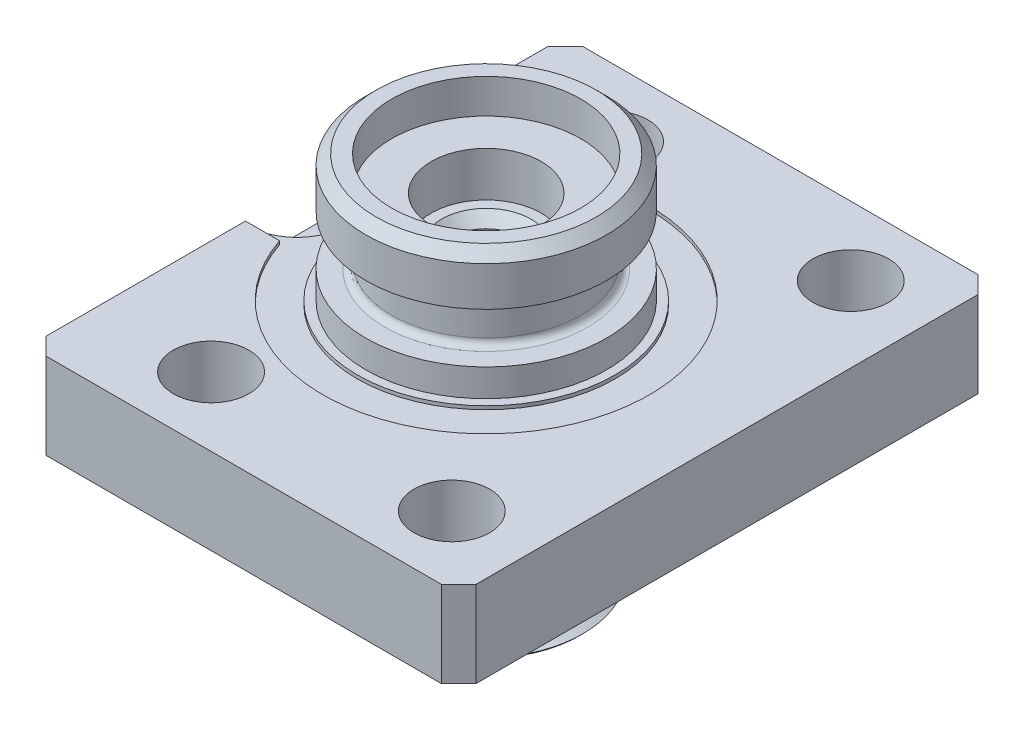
SolidWorks part; units mm, degrees
ref_plane "前视基准面" through (0, 0, 0) normal (0, 0, 1) x (1, 0, 0)
ref_plane "上视基准面" through (0, 0, 0) normal (0, 1, 0) x (1, 0, 0)
ref_plane "右视基准面" through (0, 0, 0) normal (1, 0, 0) x (0, 0, -1)
sketch "草图1" plane through (0, 0, 0) normal (1, 0, 0) x (0, 0, -1)
  line L0 (0, 0) -> (0, 4.5353) construction
  line L1 (-0.75, 0) -> (-1.6, 0)
  line L2 (-1.6, 0) -> (-1.6, -4)
  line L3 (-1.6, -4) -> (-2.1, -5)
  line L4 (-2.1, -5) -> (-3, -5)
  line L5 (-3, -5) -> (-3, -1.7)
  line L6 (-3, -1.7) -> (-2.5, -1.7)
  line L7 (-2.5, -1.7) -> (-2.5, -0.7)
  line L8 (-2.5, -0.7) -> (-5, -0.7)
  line L9 (-5, -0.7) -> (-5, 1)
  line L16 (-4, 1) -> (-1.25, 1)
  line L17 (-1.25, 1) -> (-0.75, 0.5)
  line L18 (-0.75, 0.5) -> (-0.75, 0)
  line L24 (-4, 1) -> (-5, 1)
  dimension "D1" = 0.75
  dimension "D2" = 0.5
  dimension "D3" = 1
  dimension "D4" = 45
  dimension "D5" = 1.6
  dimension "D6" = 3
  dimension "D7" = 5
  dimension "D8" = 1
  dimension "D9" = 0.5
  dimension "D10" = 0.7
  dimension "D11" = 3.3
  dimension "D12" = 0.5
  dimension "D13" = 5
revolve "旋转1" add sketch "草图1" angle 360 about L0
sketch "草图7" plane through (0, -0.7, 0) normal (0, 1, 0) x (1, 0, 0)
  line L0 (-5.25, 5.5) -> (-5.25, -5.5)
  line L1 (-3.25, -7.5) -> (3.25, -7.5)
  line L2 (5.25, -5.5) -> (5.25, 5.5)
  line L3 (3.25, 7.5) -> (-3.25, 7.5)
  line L4 (0, 0) -> (0, -4.1519) construction
  line L5 (0, 0) -> (-4.2498, 0) construction
  arc A0 (-5.25, -5.5) -> (-3.25, -7.5) centre (-3.25, -5.5) ccw
  arc A1 (3.25, -7.5) -> (5.25, -5.5) centre (3.25, -5.5) ccw
  arc A4 (5.25, 5.5) -> (3.25, 7.5) centre (3.25, 5.5) ccw
  arc A5 (-3.25, 7.5) -> (-5.25, 5.5) centre (-3.25, 5.5) ccw
  point P0 (0, 0)
  dimension "D1" = 2
  dimension "D2" = 15
  dimension "D4" = 10.5
extrude "凸台-拉伸1" add sketch "草图7" along normal blind 2
hole_wizard "M2 间隙槽口7" positions "草图8" profile "草图9" size "M2" standard "GB"
sketch "草图8" plane through (0, -0.7, 0) normal (0, -1, 0) x (-1, 0, 0)
  line L4 (0, 0) -> (0, 4.7467) construction
  line L6 (0, 0) -> (-5.268, 0) construction
  point P0 (-3.5, -4.5)
  point P2 (3.5, -4.5)
  point P6 (-3.5, 4.5)
  point P45 (3.5, 4.5)
  dimension "D1" = 9
  dimension "D2" = 7
sketch "草图9" plane through (3.5, -0.7, 4.5) normal (1, 0, 0) x (0, 0, -1)
  line L0 (0, 0) -> (0, 2)
  line L1 (0, 2) -> (1.1, 2)
  line L2 (1.1, 2) -> (1.1, 0)
  line L5 (1.1, 0) -> (0, 0)
  line L11 (0, -6.35) -> (0, 107.95) construction
  dimension "通孔孔直径" = 2.2
  dimension "通孔孔深度" = 2
chamfer "倒角1" distance 0.3 angle 45 1 edges at (0, -5, -3)
thread "螺纹线2" pitch 0.7 start angle 0, offset 1, length 3.6, pitch 0.7, diameter 6
ref_plane "基准面2" through (3, -5.7, 0) normal (0, 0, 1) x (1, 0, 0)
sketch "螺纹线轮廓2" plane through (3, -5.7, 0) normal (0, 0, 1) x (1, 0, 0)
  line L0 (0, 0) -> (0, 0.7) construction
  line L11 (0, 0) -> (0, 0.6125)
  line L12 (0, 0.6125) -> (-0.3789, 0.3937)
  line L13 (-0.3789, 0.3937) -> (-0.3789, 0.2187)
  line L15 (-0.3789, 0.2187) -> (0, 0)
  line L17 (-0.3789, 0.3062) -> (0, 0.3062) construction
  point P2 (0, 0)
  dimension "Pitch" = 0.7
  dimension "Profile_Angle" = 60
  dimension "Profile_Land" = 0.175
  dimension "Profile_Height" = 0.3789
sketch "草图10" plane through (0, 1.3, 0) normal (0, 1, 0) x (1, 0, 0)
  circle A0 centre (0, 0) radius 3.5
  dimension "D1" = 7
extrude "凸台-拉伸2" add sketch "草图10" along normal blind 2.5
sketch "草图11" plane through (0, -0.7, 0) normal (0, -1, 0) x (1, 0, 0)
  circle A1 centre (0, 0) radius 1.6
  circle A2 centre (0, 0) radius 1.6
  dimension "D1" = 0
extrude "切除-拉伸1" cut sketch "草图11" against normal blind 3.4
sketch "草图12" plane through (0, 2.7, 0) normal (0, -1, 0) x (1, 0, 0)
  circle A0 centre (0, 0) radius 1.6
  dimension "D1" = 3.2
extrude "切除-拉伸2" cut sketch "草图12" against normal through all
sketch "草图18" plane through (0, -0.7, 0) normal (0, -1, 0) x (1, 0, 0)
  line L4 (-3.25, -7.5) -> (3.25, -7.5)
  line L5 (-3.25, -7.5) -> (3.25, -7.5)
  line L6 (5.25, -5.5) -> (5.25, 5.5)
  line L7 (5.25, -5.5) -> (5.25, 5.5)
  line L8 (3.25, 7.5) -> (-3.25, 7.5)
  line L9 (3.25, 7.5) -> (-3.25, 7.5)
  line L10 (-5.25, 5.5) -> (-5.25, -5.5)
  line L11 (-5.25, 5.5) -> (-5.25, -5.5)
  circle A0 centre (0, 0) radius 2.5 construction
  circle A1 centre (0, 0) radius 2.5
  arc A4 (-5.25, -5.5) -> (-3.25, -7.5) centre (-3.25, -5.5) ccw
  arc A5 (-5.25, -5.5) -> (-3.25, -7.5) centre (-3.25, -5.5) ccw
  arc A6 (3.25, -7.5) -> (5.25, -5.5) centre (3.25, -5.5) ccw
  arc A7 (3.25, -7.5) -> (5.25, -5.5) centre (3.25, -5.5) ccw
  arc A8 (5.25, 5.5) -> (3.25, 7.5) centre (3.25, 5.5) ccw
  arc A9 (5.25, 5.5) -> (3.25, 7.5) centre (3.25, 5.5) ccw
  arc A10 (-3.25, 7.5) -> (-5.25, 5.5) centre (-3.25, 5.5) ccw
  arc A11 (-3.25, 7.5) -> (-5.25, 5.5) centre (-3.25, 5.5) ccw
  dimension "D1" = 0
extrude "切除-拉伸4" cut sketch "草图18" against normal blind 0.3
sketch "草图21" plane through (0, 3.8, 0) normal (0, 1, 0) x (1, 0, 0)
  circle A0 centre (0, 0) radius 1.6 construction
  circle A1 centre (0, 0) radius 3.5
  circle A2 centre (0, 0) radius 3.5
  circle A3 centre (0, 0) radius 1.6
  dimension "D1" = 0
extrude "凸台-拉伸4" add sketch "草图21" along normal blind 5
sketch "草图22" plane through (0, 8.8, 0) normal (0, 1, 0) x (1, 0, 0)
  line L1 (2.5, -2) -> (-2.5, -2)
  line L2 (2.5, -2) -> (2.5, 2)
  line L3 (2.5, 2) -> (-2.5, 2)
  line L4 (-2.5, -2) -> (-2.5, 2)
  line L5 (2.5, -2) -> (-2.5, 2) construction
  line L6 (2.5, 2) -> (-2.5, -2) construction
  point P0 (0, 0)
  dimension "D1" = 5
  dimension "D2" = 4
extrude "切除-拉伸5" cut sketch "草图22" against normal blind 1.46
sketch "草图24" plane through (0, 8.8, 0) normal (0, 1, 0) x (1, 0, 0)
  circle A0 centre (-2.5, -2) radius 0.65
  circle A1 centre (-2.5, 2) radius 0.65
  circle A2 centre (2.5, 2) radius 0.65
  circle A3 centre (2.5, -2) radius 0.65
  dimension "D1" = 1.3
extrude "切除-拉伸7" cut sketch "草图24" against normal up to surface (1.46 mm away)
sketch "草图14" plane through (0, 0, 0) normal (1, 0, 0) x (0, 0, -1)
  line L0 (0, 0) -> (0, 8.8498) construction
  line L1 (3.5, 1.3) -> (3.5, 8.8) construction
  line L2 (3.5, 2.9) -> (2.75, 2.9)
  line L3 (3.5, 2.9) -> (3.5, 4.35)
  line L4 (3.5, 4.35) -> (2.75, 4.35)
  line L5 (2.75, 2.9) -> (2.75, 4.35)
  line L7 (5.5, 1.3) -> (-5.5, 1.3) construction
  dimension "D1" = 1.45
  dimension "D2" = 0.75
  dimension "D3" = 1.6
revolve "切除-旋转1" cut sketch "草图14" angle 360 about L0
sketch "草图25" plane through (0, 1.3, 0) normal (0, 1, 0) x (1, 0, 0)
  line L4 (-5.25, 5.5) -> (-5.25, -5.5)
  line L5 (-3.25, -7.5) -> (3.25, -7.5)
  line L6 (5.25, -5.5) -> (5.25, 5.5)
  line L7 (3.25, 7.5) -> (-3.25, 7.5)
  line L8 (-5.25, 5.5) -> (-5.25, -5.5)
  line L9 (-3.25, -7.5) -> (3.25, -7.5)
  line L10 (5.25, -5.5) -> (5.25, 5.5)
  line L11 (3.25, 7.5) -> (-3.25, 7.5)
  circle A0 centre (-3.5, 4.5) radius 1.1 construction
  circle A1 centre (3.5, 4.5) radius 1.1 construction
  circle A2 centre (-3.5, -4.5) radius 1.1 construction
  circle A3 centre (3.5, -4.5) radius 1.1 construction
  arc A4 (-3.25, 7.5) -> (-5.25, 5.5) centre (-3.25, 5.5) ccw
  arc A5 (-5.25, -5.5) -> (-3.25, -7.5) centre (-3.25, -5.5) ccw
  arc A6 (3.25, -7.5) -> (5.25, -5.5) centre (3.25, -5.5) ccw
  arc A7 (5.25, 5.5) -> (3.25, 7.5) centre (3.25, 5.5) ccw
  arc A8 (-3.25, 7.5) -> (-5.25, 5.5) centre (-3.25, 5.5) ccw
  arc A9 (-5.25, -5.5) -> (-3.25, -7.5) centre (-3.25, -5.5) ccw
  arc A10 (3.25, -7.5) -> (5.25, -5.5) centre (3.25, -5.5) ccw
  arc A11 (5.25, 5.5) -> (3.25, 7.5) centre (3.25, 5.5) ccw
  circle A12 centre (-3.5, 4.5) radius 1.1
  circle A13 centre (3.5, 4.5) radius 1.1
  circle A14 centre (-3.5, -4.5) radius 1.1
  circle A15 centre (3.5, -4.5) radius 1.1
  dimension "D1" = 0
extrude "凸台-拉伸5" add sketch "草图25" along normal blind 0.8
sketch "草图29" plane through (0, 2.1, 0) normal (0, 1, 0) x (1, 0, 0)
  circle A0 centre (0, 0) radius 1
  dimension "D1" = 2
extrude "切除-拉伸10" cut sketch "草图29" against normal through all
sketch "草图30" plane through (0, 2.1, 0) normal (0, 1, 0) x (1, 0, 0)
  circle A0 centre (0, 0) radius 1 construction
  circle A1 centre (0, 0) radius 1.6
  circle A2 centre (0, 0) radius 1.6
  circle A3 centre (0, 0) radius 1
  dimension "D1" = 0
extrude "凸台-拉伸6" add sketch "草图30" along normal blind 1.4
sketch "草图31" plane through (0, 1.3, 0) normal (0, -1, 0) x (1, 0, 0)
  circle A0 centre (0, 0) radius 1 construction
  circle A1 centre (0, 0) radius 1.6
  circle A2 centre (0, 0) radius 1.6
  circle A3 centre (0, 0) radius 1
  dimension "D1" = 0
extrude "切除-拉伸11" cut sketch "草图31" against normal blind 1.4
fillet "圆角3" radius 0.2 2 edges at (0, 2.9, -2.75) (0, 4.35, -2.75)
chamfer "倒角9" distance 0.3 angle 45 1 edges at (0, 3.5, 1)
chamfer "倒角10" distance 0.3 angle 45 4 edges at (-2.5, 8.8, 0) (0, 8.8, -2) (0, 8.8, 2) (2.5, 8.8, 0)
chamfer "倒角11" distance 0.3 angle 45 1 edges at (0, 7.34, 1.6)
sketch "草图32" plane through (0, 8.8, 0) normal (0, 1, 0) x (1, 0, 0)
  circle A0 centre (0, 0) radius 7.8107
extrude "切除-拉伸12" cut sketch "草图32" against normal blind 3
sketch "草图34" plane through (0, 5.8, 0) normal (0, 1, 0) x (1, 0, 0)
  circle A0 centre (0, 0) radius 2.75
  dimension "D1" = 5.5
extrude "切除-拉伸13" cut sketch "草图34" against normal blind 1
chamfer "倒角13" distance 0.3 angle 45 1 edges at (0, 5.8, 3.5)
sketch "草图36" plane through (0, -0.4, 0) normal (0, -1, 0) x (1, 0, 0)
  line L0 (-5.25, -5.5) -> (-5.25, -7.5)
  line L1 (7, -7.5) -> (-5.25, -7.5)
  line L2 (7, 7.335) -> (7, -7.335) construction
  line L3 (7, -7.5) -> (7, 7.5)
  line L4 (5.25, -5.5) -> (5.25, 5.5)
  line L5 (3.25, 7.5) -> (-3.25, 7.5)
  line L6 (-5.25, 5.5) -> (-5.25, -5.5)
  line L7 (-3.25, -7.5) -> (3.25, -7.5)
  line L9 (3.25, 7.5) -> (-3.25, 7.5)
  line L10 (-5.25, -5.5) -> (-5.25, 7.5)
  line L11 (-3.25, -7.5) -> (3.25, -7.5)
  line L12 (7, 7.5) -> (-5.25, 7.5)
  arc A4 (3.25, -7.5) -> (5.25, -5.5) centre (3.25, -5.5) ccw
  arc A5 (5.25, 5.5) -> (3.25, 7.5) centre (3.25, 5.5) ccw
  arc A6 (-3.25, 7.5) -> (-5.25, 5.5) centre (-3.25, 5.5) ccw
  arc A7 (-5.25, -5.5) -> (-3.25, -7.5) centre (-3.25, -5.5) ccw
  dimension "D2" = 15
  dimension "D1" = 0
extrude "凸台-拉伸7" add sketch "草图36" against normal up to surface (2.5 mm away) contours L3 L12 L1 M12 M11 M10 | M20 | M17 M10 M11 M12 M13 M14 M15 M16 M19 M21 M20 M18 M9 | L1 L0 M16 | L12 L10 M14
sketch "草图37" plane through (0, -0.4, 0) normal (0, -1, 0) x (1, 0, 0)
  circle A0 centre (-3.5, -4.5) radius 1.1 construction
  circle A1 centre (-3.5, -4.5) radius 1.1
  circle A2 centre (-3.5, 4.5) radius 1.1 construction
  circle A3 centre (-3.5, 4.5) radius 1.1
  circle A4 centre (3.5, 4.5) radius 1.1 construction
  circle A5 centre (3.5, 4.5) radius 1.1
extrude "凸台-拉伸8" add sketch "草图37" against normal up to surface (2.5 mm away)
sketch "草图38" plane through (0, -0.4, 0) normal (0, -1, 0) x (1, 0, 0)
  circle A0 centre (-2.2, -5.8) radius 1.1
  circle A1 centre (4.8, -5.8) radius 1.1
  circle A2 centre (4.8, 5.8) radius 1.1
  circle A3 centre (-2.2, 5.8) radius 1.1
  dimension "D1" = 2.2
extrude "切除-拉伸14" cut sketch "草图38" against normal through all
sketch "草图39" plane through (0, 2.1, 0) normal (0, 1, 0) x (1, 0, 0)
  line L0 (7, 7.5) -> (7, -7.5) construction
  line L1 (-5.25, -7.5) -> (7, -7.5)
  line L2 (-5.25, -7.5) -> (-5.25, -7.8)
  line L3 (-5.25, -7.8) -> (7, -7.8)
  line L4 (7, -7.5) -> (7, -7.8)
  line L5 (-5.25, 7.5) -> (7, 7.5)
  line L6 (-5.25, 7.5) -> (-5.25, 7.8)
  line L7 (-5.25, 7.8) -> (7, 7.8)
  line L8 (7, 7.5) -> (7, 7.8)
  dimension "D1" = 0.3
  dimension "D2" = 0.3
extrude "凸台-拉伸9" add sketch "草图39" against normal up to surface (2.5 mm away)
sketch "草图40" plane through (-5.25, 0, 0) normal (-1, 0, 0) x (0, 0, 1)
  line L4 (-7.8, -0.4) -> (7.8, -0.4)
  line L5 (7.8, -0.4) -> (7.8, 2.1)
  line L6 (7.8, 2.1) -> (-7.8, 2.1)
  line L7 (-7.8, 2.1) -> (-7.8, -0.4)
  line L8 (-7.8, -0.4) -> (7.8, -0.4)
  line L9 (7.8, -0.4) -> (7.8, 2.1)
  line L10 (7.8, 2.1) -> (-7.8, 2.1)
  line L11 (-7.8, 2.1) -> (-7.8, -0.4)
  dimension "D1" = 0
extrude "凸台-拉伸10" add sketch "草图40" along normal blind 0.25
chamfer "倒角14" distance 0.5 angle 45 4 edges at (7, 0.85, -7.8) (7, 0.85, 7.8) (-5.5, 0.85, 7.8) (-5.5, 0.85, -7.8)
sketch "草图41" plane through (0, 2.1, 0) normal (0, 1, 0) x (1, 0, 0)
  circle A0 centre (0, 0) radius 3.75
  circle A1 centre (0, 0) radius 4.75
  dimension "D1" = 7.5
  dimension "D2" = 9.5
extrude "切除-拉伸16" cut sketch "草图41" against normal blind 0.1
sketch "草图42" plane through (0, 2.1, 0) normal (0, 1, 0) x (1, 0, 0)
  line L0 (0, 0) -> (-6.9078, 0) construction
  line L1 (-3.4369, 1.5) -> (-5.5, 1.5)
  line L2 (-3.4369, -1.5) -> (-5.5, -1.5)
  line L3 (-5.5, -1.5) -> (-5.5, 1.5)
  line L5 (0, -1.5) -> (-6.9078, -1.5) construction
  line L6 (0, 1.5) -> (-6.9078, 1.5) construction
  circle A0 centre (0, 0) radius 3.75 construction
  arc A1 (-3.4369, 1.5) -> (-3.4369, -1.5) centre (0, 0) ccw
  dimension "D1" = 1.5
  dimension "D2" = 1.5
extrude "切除-拉伸17" cut sketch "草图42" against normal up to surface (0.1 mm away)
sketch "草图43" plane through (0, 2, 0) normal (0, 1, 0) x (1, 0, 0)
  line L0 (-5.5, -1.5) -> (-5.5, 1.5)
  arc A0 (-5.5, -1.5) -> (-5.5, 1.5) centre (-5.5, 0) ccw
extrude "切除-拉伸18" cut sketch "草图43" against normal blind 1
